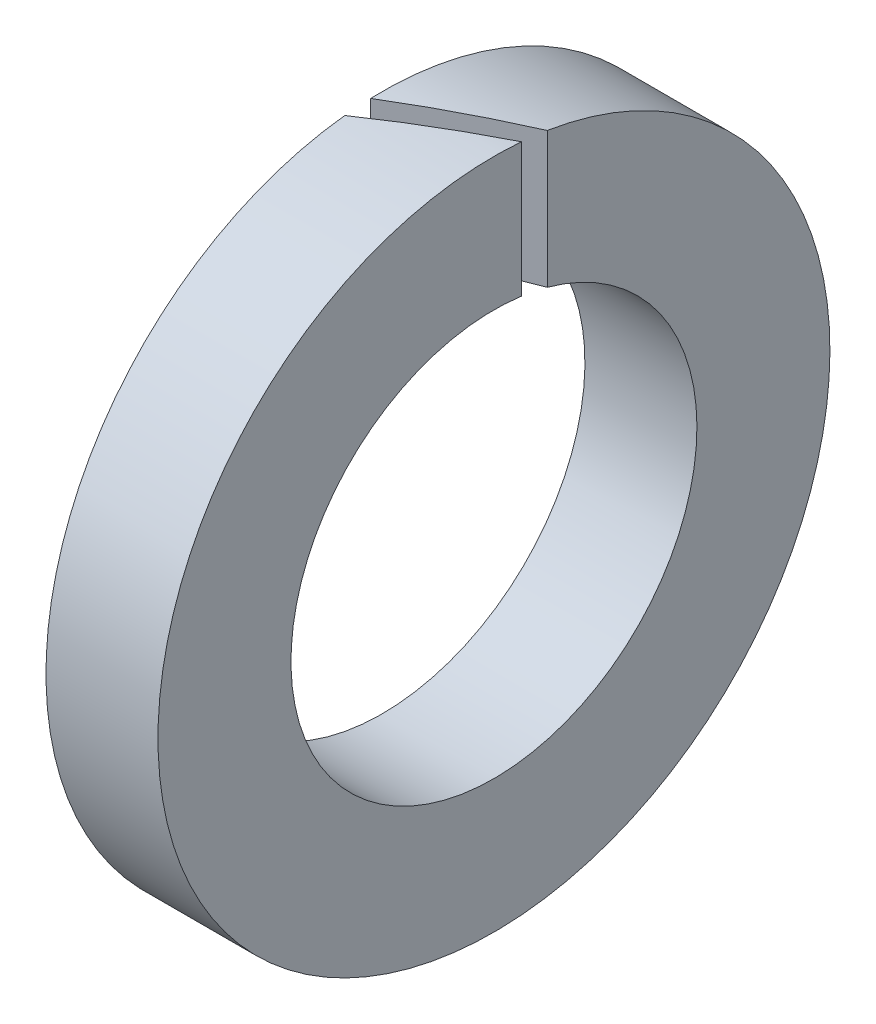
SolidWorks part; units mm, degrees
ref_plane "Plan1" through (0, 0, 0) normal (0, 0, 1) x (1, 0, 0)
ref_plane "Plan2" through (0, 0, 0) normal (0, 1, 0) x (1, 0, 0)
ref_plane "Plan3" through (0, 0, 0) normal (1, 0, 0) x (0, 0, -1)
sketch "Esquisse1" plane through (0, 0, 0) normal (1, 0, 0) x (0, 0, -1)
  circle A0 centre (0, 0) radius 12
  circle A1 centre (0, 0) radius 7.25
  dimension "D1" = 24
  dimension "D2" = 14.5
extrude "Base-Extrusion" add sketch "Esquisse1" along normal blind 4
sketch "Esquisse2" plane through (0, 0, 0) normal (0, 1, 0) x (1, 0, 0)
  line L0 (-0.4428, -0.6598) -> (-0.089, -1.3793)
  line L1 (4.0264, 1.9205) -> (4.4264, 1.2277)
  line L7 (-0.089, -1.3793) -> (4.4264, 1.2277)
  line L8 (-0.4428, -0.6598) -> (4.0264, 1.9205)
extrude "Enlèv. mat.-Extru.1" cut sketch "Esquisse2" along normal through all
